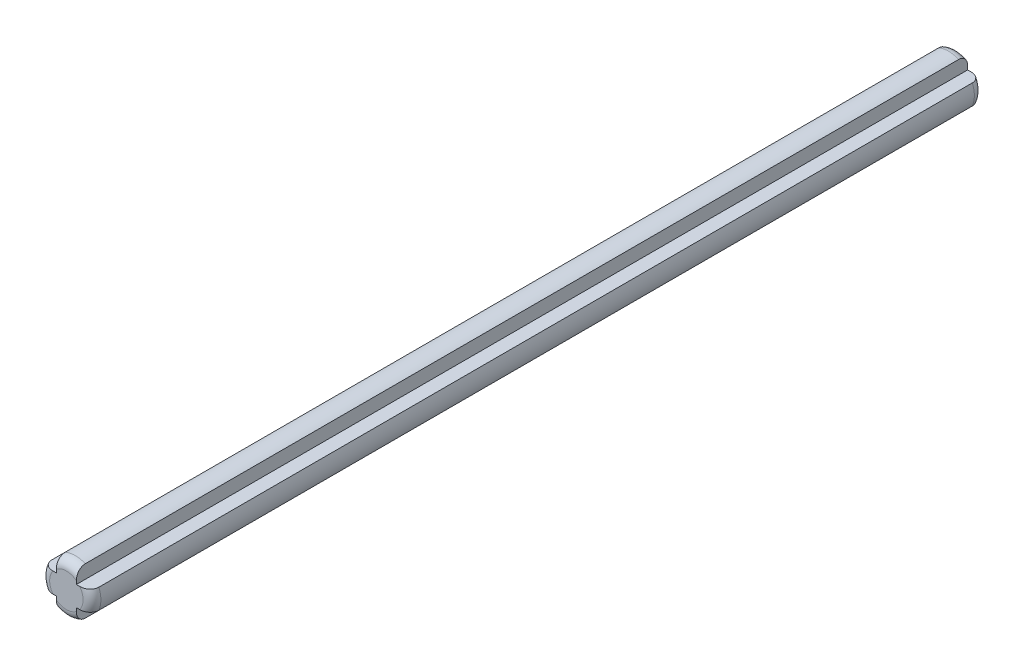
SolidWorks part; units mm, degrees
ref_plane "Front Plane" through (0, 0, 0) normal (0, 0, 1) x (1, 0, 0)
ref_plane "Top Plane" through (0, 0, 0) normal (0, 1, 0) x (1, 0, 0)
ref_plane "Right Plane" through (0, 0, 0) normal (1, 0, 0) x (0, 0, -1)
sketch "Sketch1" plane through (0, 0, 0) normal (0, 0, 1) x (1, 0, 0)
  line L0 (-0.9, 2.1166) -> (-0.9, 0.9)
  line L1 (-0.9, 0.9) -> (-2.1166, 0.9)
  line L2 (0, 3.8484) -> (0, -4.1163) construction
  line L3 (-3.3115, 0) -> (4.7978, 0) construction
  line L4 (-0.9, -2.1166) -> (-0.9, -0.9)
  line L5 (-0.9, -0.9) -> (-2.1166, -0.9)
  line L6 (0.9, -2.1166) -> (0.9, -0.9)
  line L7 (0.9, -0.9) -> (2.1166, -0.9)
  line L8 (0.9, 2.1166) -> (0.9, 0.9)
  line L9 (0.9, 0.9) -> (2.1166, 0.9)
  circle A0 centre (0, 0) radius 2.3
  dimension "D1" = 4.6
  dimension "D2" = 0.9
  dimension "D3" = 0.9
extrude "Boss-Extrude1" add sketch "Sketch1" against normal blind 80 contours L8 A0 L0 L1 L5 L4 L6 L7 L9
fillet "Fillet1" radius 0.8 8 edges at (2.3, 0, -80) (0, 2.3, -80) (-2.3, 0, -80) (2.3, 0, 0) (0, -2.3, -80) (0, -2.3, 0) (-2.3, 0, 0) (0, 2.3, 0)
ref_plane "Midplane" through (0, 0, -40) normal (0, 0, 1) x (1, 0, 0)
